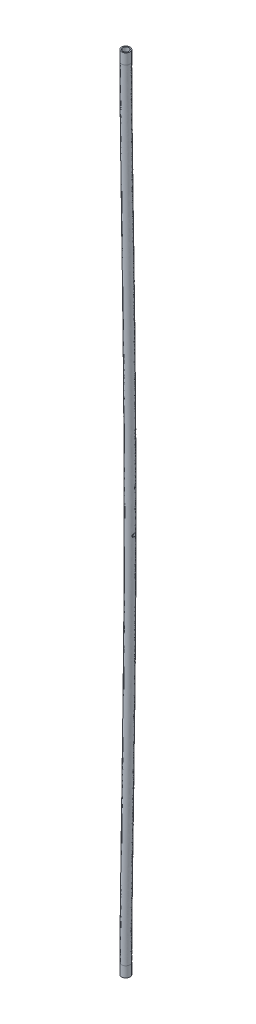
SolidWorks part; units mm, degrees
ref_plane "Ebene vorne" through (0, 0, 0) normal (0, 0, 1) x (1, 0, 0)
ref_plane "Ebene oben" through (0, 0, 0) normal (0, 1, 0) x (1, 0, 0)
ref_plane "Ebene rechts" through (0, 0, 0) normal (1, 0, 0) x (0, 0, -1)
sketch "Pfad" plane through (0, 0, 0) normal (0, 0, 1) x (1, 0, 0)
  line L0 (0, 0) -> (0, 760) construction
  line L1 (0, 0) -> (0, 10)
  line L2 (0, 760) -> (0, 750)
  spline S0 degree 3 poles (0, 750) (0, 674.1154) (8.06, 385.6992) (0, 74.4862) (0, 10) knots 0 0 0 0 0.5 1 1 1 1
  point P2 (0, 380)
  dimension "D1" = 760
  dimension "D2" = 10
  dimension "D3" = 4.03
sketch "Kontur" plane through (0, 0, 0) normal (0, 1, 0) x (1, 0, 0)
  circle A0 centre (0, 0) radius 4
  circle A1 centre (0, 0) radius 3
  dimension "D1" = 1
  dimension "Durchmesser" = 8
sweep "Austragung2" add profiles "Kontur" path "Pfad"
sketch "Skizze1" plane through (0, 0, 0) normal (1, 0, 0) x (0, 0, -1)
  circle A0 centre (0, 365) radius 1.75
  dimension "D1" = 3.5
  dimension "D2" = 365
extrude "Aufsatz-Linear austragen1" add sketch "Skizze1" along normal through all
sketch "Skizze2" plane through (0, 0, 0) normal (-1, 0, 0) x (0, 0, 1)
  circle A0 centre (0, 365) radius 1
  dimension "D1" = 2
extrude "Schnitt-Linear austragen1" cut sketch "Skizze2" against normal through all
